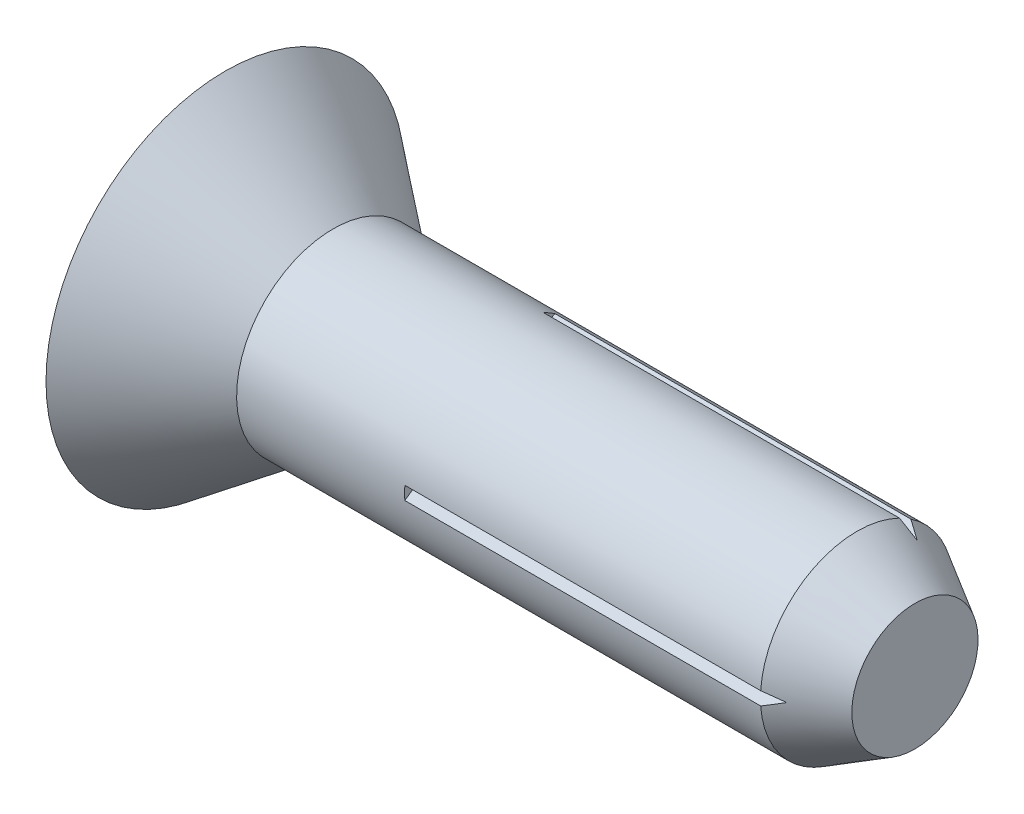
SolidWorks part; units mm, degrees
ref_plane "Front" through (0, 0, 0) normal (0, 0, 1) x (1, 0, 0)
ref_plane "Top" through (0, 0, 0) normal (0, 1, 0) x (1, 0, 0)
ref_plane "Right" through (0, 0, 0) normal (1, 0, 0) x (0, 0, -1)
sketch "Sketch1" plane through (2.3276, 1.6276, 0) normal (0, 0, 1) x (0, 1, 0)
  line L0 (-1.6276, -2.6724) -> (-1.1701, -2.6724)
  line L1 (-1.1701, -2.6724) -> (-0.9276, -2.2524)
  line L2 (-0.9276, -2.2524) -> (-0.9276, 2.3276)
  line L3 (-0.9276, 2.3276) -> (-1.6276, 2.3276)
  line L4 (-1.6276, 2.3276) -> (-1.6276, -2.6724)
  line L5 (-1.6276, 13.4318) -> (-1.6276, -14.8213) construction
  dimension "l" = 5
  dimension "d" = 1.4
  dimension "D3" = 30
  dimension "C" = 0.42
revolve "Base-Revolve" add sketch "Sketch1" angle 360 about L5
ref_plane "Plane1" through (5, 0, 0) normal (1, 0, 0) x (0, 0, -1)
sketch "Sketch2" plane through (5, 0, 0) normal (1, 0, 0) x (0, 0, -1)
  line L0 (-0.049, -0.7) -> (0, -0.63)
  line L1 (0, -0.63) -> (0.049, -0.7)
  line L2 (0.049, -0.7) -> (-0.049, -0.7)
  line L3 (0, -1.1035) -> (0, 0.4817) construction
  dimension "D1" = 70
  dimension "D2" = 35
  dimension "D3" = 0.7
  dimension "D4" = 0.63
extrude "Cut-Extrude1" [suppressed] cut sketch "Sketch2" against normal blind 3.75
pattern_circular "CirPattern1" [suppressed] count 3 over 360 about axis through (-11.1041, 0, 0) along (1, 0, 0)
sketch "Sketch3" plane through (4.2526, 2.9526, 0) normal (0, 0, 1) x (0, 1, 0)
  line L0 (-2.9526, 4.2526) -> (-1.6526, 4.2526)
  line L1 (-3.4101, -0.7474) -> (-2.495, -0.7474) construction
  line L2 (-2.9526, 5.1526) -> (-2.9526, 4.2526)
  line L5 (-2.9526, 7.336) -> (-2.9526, -1.6257) construction
  arc A0 (-1.6526, 4.2526) -> (-2.9526, 5.1526) centre (-2.9526, 3.7637) ccw
  dimension "D1" = 5
  dimension "k" = 0.9
  dimension "dk" = 2.6
revolve "Revolve1" [suppressed] add sketch "Sketch3" angle 360 about L5
sketch "Sketch6" plane through (5, 0, 0) normal (1, 0, 0) x (0, 0, -1)
  line L0 (-0.7, 0.049) -> (-0.63, 0)
  line L1 (-0.63, 0) -> (-0.7, -0.049)
  line L2 (-0.7, 0.049) -> (-0.7, -0.049)
  line L3 (-0.8611, 0) -> (0.1904, 0) construction
  dimension "D1" = 70
  dimension "D2" = 35
  dimension "D3" = 0.7
  dimension "D4" = 0.63
extrude "Cut-Extrude2" cut sketch "Sketch6" against normal blind 3
pattern_circular "CirPattern2" count 3 over 360 about axis through (0, 0, 0) along (1, 0, 0) of "Cut-Extrude2"
sketch "Sketch7" plane through (3.6006, 2.3006, 0) normal (0, 0, 1) x (0, 1, 0)
  line L0 (-2.3006, 4.0408) -> (-2.3006, -1.3994) construction
  line L2 (-2.3006, 3.6006) -> (-1.0006, 3.6006)
  line L3 (-1.0006, 3.6006) -> (-1.6006, 2.8186)
  line L4 (-1.6006, 2.8186) -> (-2.3006, 2.8186)
  line L5 (-2.3006, 3.6006) -> (-2.3006, 2.8186)
  dimension "D1" = 5
  dimension "dk" = 2.6
  dimension "D2" = 37.5
  dimension "D3" = 1.4
revolve "Revolve2" add sketch "Sketch7" angle 360 about L0
equation "\"D3@Sketch2\" = \"d@Sketch1\" / 2"
equation "\"D4@Sketch2\" = \"D3@Sketch2\" * 0.9"
equation "\"D1@Cut-Extrude1\" = \"l@Sketch1\" * 0.75"
equation "\"D3@Sketch6\" = \"d@Sketch1\" / 2"
equation "\"D4@Sketch6\" = \"D3@Sketch6\" * 0.9"
equation "\"D1@Cut-Extrude2\" = \"l@Sketch1\" * 0.6"
equation "\"D1@Sketch3\" = \"l@Sketch1\""
equation "\"D1@Sketch7\" = \"l@Sketch1\""
equation "\"D3@Sketch7\" = \"d@Sketch1\""
